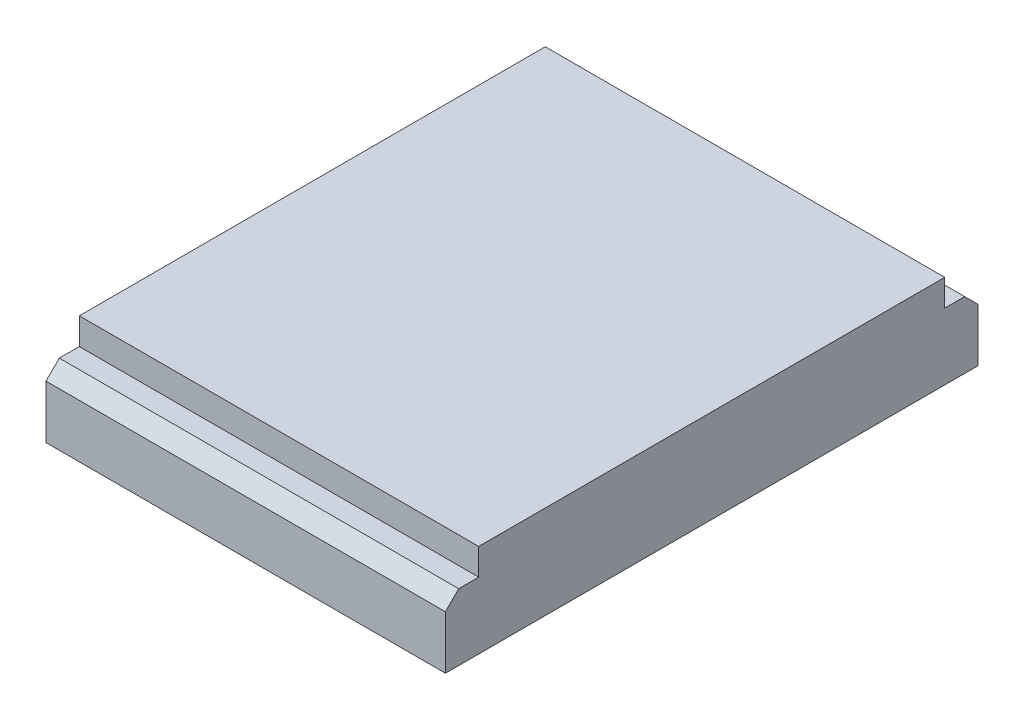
SolidWorks part; units mm, degrees
ref_plane "Front" through (0, 0, 0) normal (0, 0, 1) x (1, 0, 0)
ref_plane "Top" through (0, 0, 0) normal (0, 1, 0) x (1, 0, 0)
ref_plane "Right" through (0, 0, 0) normal (1, 0, 0) x (0, 0, -1)
sketch "Sketch1" plane through (0, 0, 0) normal (0, 1, 0) x (1, 0, 0)
  line L0 (0, 0) -> (30, 0) construction
  line L1 (0, 20) -> (30, 20)
  line L2 (0, 20) -> (0, -20)
  line L3 (0, -20) -> (30, -20)
  line L4 (30, 20) -> (30, -20)
  dimension "D1" = 30
  dimension "D2" = 40
extrude "Extrude1" add sketch "Sketch1" along normal blind 5
sketch "Sketch2" plane through (0, 5, 0) normal (0, 1, 0) x (-1, 0, 0)
  line L0 (0, -20) -> (0, 20) construction
  line L1 (0, -17.5) -> (-30, -17.5)
  line L2 (0, -17.5) -> (0, 17.5)
  line L3 (0, 17.5) -> (-30, 17.5)
  line L4 (-30, -17.5) -> (-30, 17.5)
  line L5 (-30, 0) -> (0, 0) construction
  dimension "D1" = 35
  dimension "D2" = 30
extrude "Extrude2" add sketch "Sketch2" along normal blind 2
chamfer "Chamfer1" distance 1 angle 45 4 edges at (15, 5, -20) (15, 5, 20)
